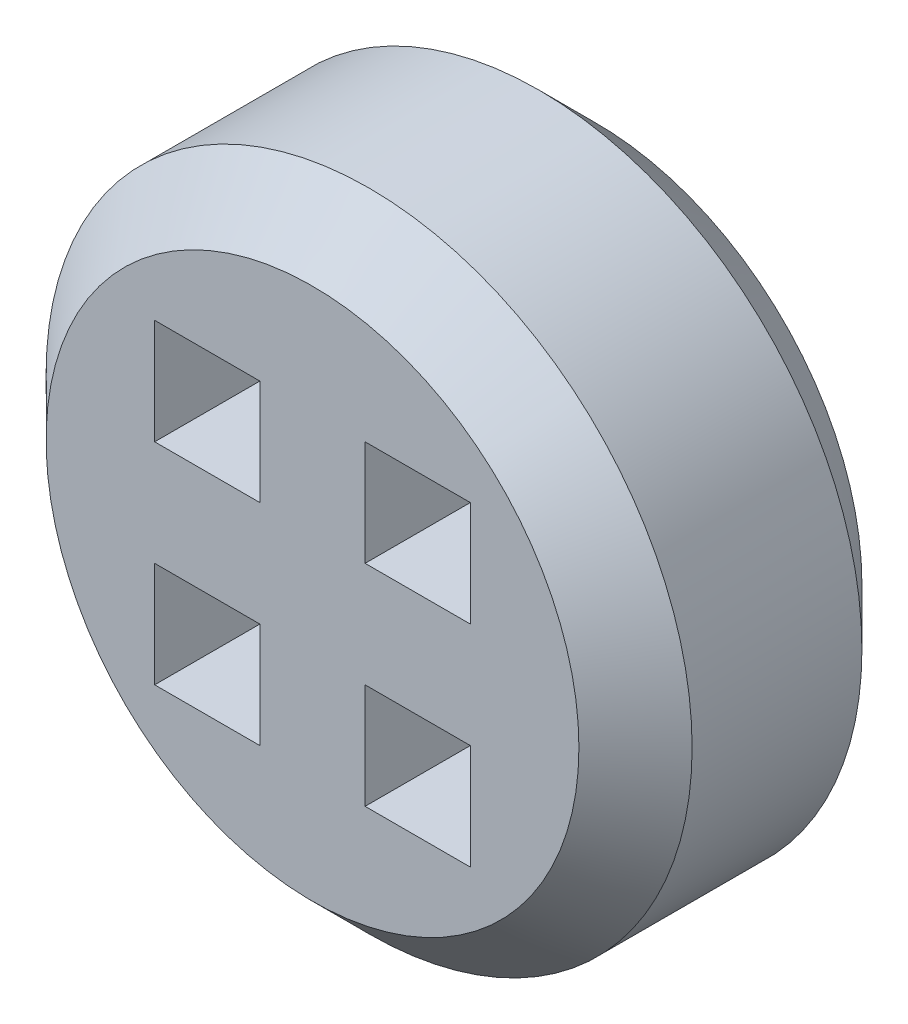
SolidWorks part; units mm, degrees
ref_plane "Přední rovina" through (0, 0, 0) normal (0, 0, 1) x (1, 0, 0)
ref_plane "Horní rovina" through (0, 0, 0) normal (0, 1, 0) x (1, 0, 0)
ref_plane "Pravá rovina" through (0, 0, 0) normal (1, 0, 0) x (0, 0, -1)
sketch "Skica1" plane through (0, 0, 0) normal (0, 0, 1) x (1, 0, 0)
  circle A0 centre (0, 0) radius 57.071
extrude "Přidat vysunutím1" add sketch "Skica1" along normal blind 50
sketch "Skica2" plane through (0, 0, 50) normal (0, 0, 1) x (1, 0, 0)
  circle A0 centre (-28.4901, 25.2332) radius 8.4916
  circle A1 centre (15.0465, 21.4689) radius 7.0692
  circle A2 centre (-9.5354, -23.9031) radius 17.465
extrude "Odebrat vysunutím1" [suppressed] cut sketch "Skica2" against normal up to next
sketch "Skica3" [suppressed] plane through (0, 0, 50) normal (0, 0, 1) x (1, 0, 0)
  line L1 (-13.8093, 12.4473) -> (-35.3687, 24.8946)
  line L2 (-35.3687, 24.8946) -> (-35.3687, 0)
  line L3 (-35.3687, 0) -> (-13.8093, 12.4473)
  line L4 (13.8093, 12.4473) -> (35.3687, 0)
  line L5 (35.3687, 0) -> (35.3687, 24.8946)
  line L6 (35.3687, 24.8946) -> (13.8093, 12.4473)
  line L7 (0, -18.5912) -> (-12.4473, -40.1506)
  line L8 (-12.4473, -40.1506) -> (12.4473, -40.1506)
  line L9 (12.4473, -40.1506) -> (0, -18.5912)
  circle A0 centre (-28.1822, 12.4473) radius 7.1865 construction
  circle A1 centre (28.1822, 12.4473) radius 7.1865 construction
  circle A2 centre (0, -32.9641) radius 7.1865 construction
  circle A3 centre (0, 0) radius 18.5912 construction
extrude "Odebrat vysunutím2" [suppressed] cut sketch "Skica3" against normal up to next
sketch "Skica4" plane through (0, 0, 50) normal (0, 0, 1) x (1, 0, 0)
  line L0 (-9.2956, 9.2956) -> (9.2956, 9.2956) construction
  line L1 (9.2956, 27.8868) -> (27.8868, 27.8868)
  line L2 (9.2956, 27.8868) -> (9.2956, 9.2956)
  line L3 (9.2956, 9.2956) -> (27.8868, 9.2956)
  line L4 (27.8868, 27.8868) -> (27.8868, 9.2956)
  line L5 (-9.2956, 9.2956) -> (-9.2956, -9.2956) construction
  line L6 (-9.2956, -9.2956) -> (9.2956, -9.2956) construction
  line L7 (9.2956, 9.2956) -> (9.2956, -9.2956) construction
  line L8 (-9.2956, 9.2956) -> (9.2956, -9.2956) construction
  line L9 (-27.8868, 27.8868) -> (-9.2956, 27.8868)
  line L10 (-27.8868, 27.8868) -> (-27.8868, 9.2956)
  line L11 (-27.8868, 9.2956) -> (-9.2956, 9.2956)
  line L12 (-9.2956, 27.8868) -> (-9.2956, 9.2956)
  line L13 (-27.8868, -9.2956) -> (-9.2956, -9.2956)
  line L14 (-27.8868, -9.2956) -> (-27.8868, -27.8868)
  line L15 (-27.8868, -27.8868) -> (-9.2956, -27.8868)
  line L16 (-9.2956, -9.2956) -> (-9.2956, -27.8868)
  line L17 (9.2956, -9.2956) -> (27.8868, -9.2956)
  line L18 (9.2956, -9.2956) -> (9.2956, -27.8868)
  line L19 (9.2956, -27.8868) -> (27.8868, -27.8868)
  line L20 (27.8868, -9.2956) -> (27.8868, -27.8868)
extrude "Odebrat vysunutím3" cut sketch "Skica4" against normal up to next
sketch "Skica5" [suppressed] plane through (0, 0, 50) normal (0, 0, 1) x (1, 0, 0)
  line L0 (0, 16.4664) -> (-9.0183, -3.9781)
  line L1 (-9.0183, -3.9781) -> (9.0183, -3.9781)
  line L2 (9.0183, -3.9781) -> (0, 16.4664)
  line L3 (0, 16.4664) -> (0, -3.9781) construction
  line L4 (9.0183, -3.9781) -> (-6.0804, 2.6821) construction
  arc A0 (-33.018, -17.8776) -> (33.018, -17.8776) centre (0, 0) ccw
  arc A1 (-33.018, -17.8776) -> (33.018, -17.8776) centre (0, 16.4664) ccw
  arc A2 (-13.0995, 16.4664) -> (-42.1543, 16.4664) centre (-27.6269, 8.079) ccw
  arc A3 (-42.1543, 16.4664) -> (-13.0995, 16.4664) centre (-27.6269, 24.8539) ccw
  arc A4 (42.1543, 16.4664) -> (13.0995, 16.4664) centre (27.6269, 24.8539) cw
  arc A5 (13.0995, 16.4664) -> (42.1543, 16.4664) centre (27.6269, 8.079) cw
  point P5 (-6.0804, 2.6821)
  point P9 (0, 0)
extrude "Přidat vysunutím2" [suppressed] add sketch "Skica5" along normal blind 5
fillet "Zaoblit1" [suppressed] radius 10
chamfer "Zkosení1" distance 10 angle 45 2 edges at (57.071, 0, 0) (57.071, 0, 50)
sketch "Skica6" [suppressed] plane through (0, 0, 50) normal (0, 0, 1) x (1, 0, 0)
  circle A0 centre (0, 0) radius 57.071 construction
  circle A1 centre (0, 0) radius 57.071
  circle A2 centre (0, 0) radius 51.3228
extrude "Odebrat vysunutím4" [suppressed] cut sketch "Skica6" against normal blind 25
chamfer "Zkosení2" [suppressed] distance 40 angle 15
fillet "Zaoblit2" [suppressed] radius 30
